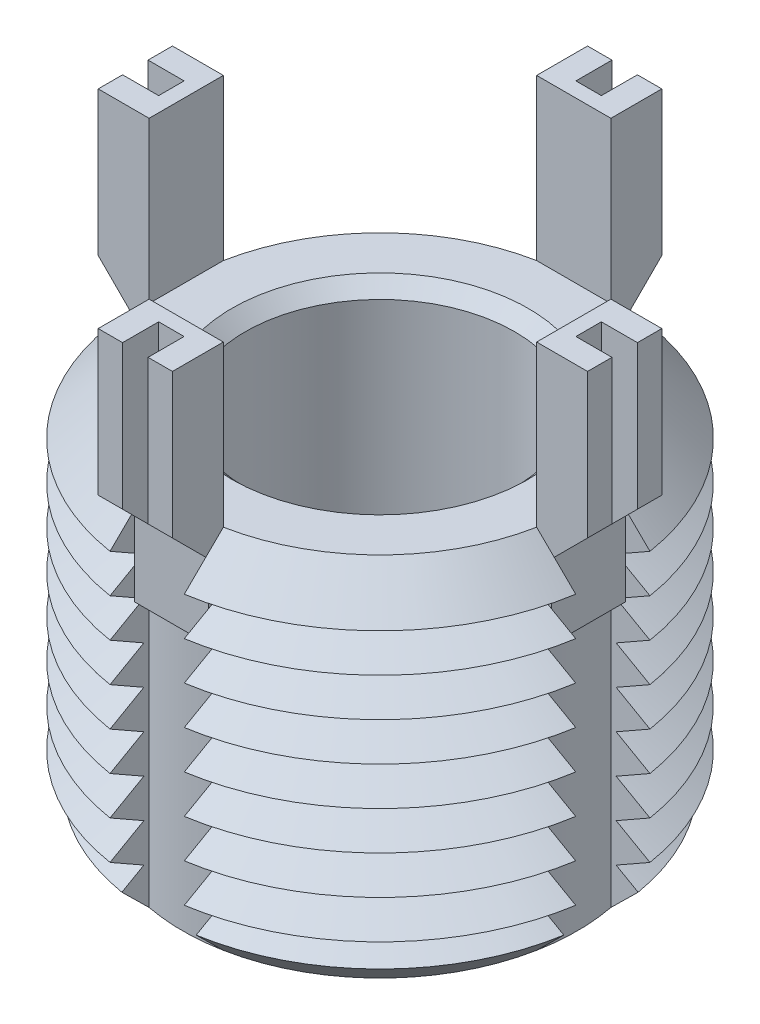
SolidWorks part; units mm, degrees
ref_plane "Front Plane" through (0, 0, 0) normal (0, 0, 1) x (1, 0, 0)
ref_plane "Top Plane" through (0, 0, 0) normal (0, 1, 0) x (1, 0, 0)
ref_plane "Right Plane" through (0, 0, 0) normal (1, 0, 0) x (0, 0, -1)
sketch "Sketch1" plane through (0, 0, 0) normal (0, 1, 0) x (1, 0, 0)
  circle A0 centre (0, 0) radius 11.1125
  dimension "D1" = 22.225
extrude "Boss-Extrude1" add sketch "Sketch1" against normal blind 17.272
chamfer "Chamfer1" distance 1.814 angle 45 2 edges at (0, -17.272, 11.1125) (0, 0, 11.1125)
sketch "Sketch2" plane through (0, 0, 0) normal (1, 0, 0) x (0, 0, -1)
  line L0 (0, 0.8859) -> (0, -9.2617) construction
sketch "Sketch3" plane through (0, 0, 0) normal (1, 0, 0) x (0, 0, -1)
  line L0 (-11.1125, -1.814) -> (-9.5415, -2.721)
  line L1 (-9.5415, -2.721) -> (-11.1125, -3.628)
  line L2 (-11.1125, -1.814) -> (-11.1125, -15.458) construction
  line L3 (-11.1125, -3.628) -> (-11.1125, -1.814)
  dimension "D1" = 1.814
revolve "Cut-Revolve1" cut sketch "Sketch3" angle 360 about L0
pattern_linear "LPattern1" count 8 spacing 1.814 along (0, -1, 0) of "Cut-Revolve1"
sketch "Sketch4" plane through (0, 0, 0) normal (0, 1, 0) x (1, 0, 0)
  line L0 (-9.1323, 1.75) -> (-10.9738, 1.75)
  line L2 (-10.9738, -1.75) -> (-9.1323, -1.75)
  arc A0 (-9.1323, 1.75) -> (-9.1323, -1.75) centre (0, 0) ccw
  arc A1 (-10.9738, 1.75) -> (-10.9738, -1.75) centre (0, 0) ccw
  circle A2 centre (0, 0) radius 11.1125 construction
  circle A3 centre (0, 0) radius 9.2985 construction
  point P1 (-9.2985, 0)
  point P3 (-11.1125, 0)
  point P13 (0, 0)
  dimension "D1" = 3.5
extrude "Cut-Extrude1" cut sketch "Sketch4" against normal up to surface (17.272 mm away)
pattern_circular "CirPattern1" count 4 over 360 about axis through (0, 0, 0) along (0, 1, 0) of "Cut-Extrude1"
sketch "Sketch5" plane through (0, 0, 0) normal (1, 0, 0) x (0, 0, -1)
  line L0 (-9.1323, 7.558) -> (-9.1323, -4.442)
  line L1 (-9.1323, -4.442) -> (-9.8323, -4.442)
  line L2 (-9.8323, -4.442) -> (-9.8323, -0.942)
  line L3 (-9.8323, -0.942) -> (-11.5323, 0.758)
  line L4 (-11.5323, 0.758) -> (-11.5323, 7.558)
  line L5 (-11.5323, 7.558) -> (-9.1323, 7.558)
  line L6 (-10.9738, -5.442) -> (-1.75, -5.442) construction
  point P9 (-1.75, 0)
  point P10 (-9.8323, -0.942)
  dimension "D1" = 1
  dimension "D2" = 12
  dimension "D3" = 8.5
  dimension "D4" = 2.4
  dimension "D5" = 0.7
  dimension "D6" = 45
extrude "Boss-Extrude3" add sketch "Sketch5" along normal mid plane 3.5
pattern_circular "CirPattern2" count 4 over 360 about axis through (0, 0, 0) along (0, 1, 0) of "Boss-Extrude3"
sketch "Sketch6" plane through (0, 7.558, 0) normal (0, 1, 0) x (1, 0, 0)
  line L0 (-11.5323, -1.75) -> (-11.5323, 1.75) construction
  line L1 (-11.5323, -0.6) -> (-9.8323, -0.6)
  line L2 (-11.5323, -0.6) -> (-11.5323, 0.6)
  line L3 (-11.5323, 0.6) -> (-9.8323, 0.6)
  line L4 (-9.8323, -0.6) -> (-9.8323, 0.6)
  line L5 (-11.5323, -0.6) -> (-9.8323, 0.6) construction
  line L6 (-11.5323, 0.6) -> (-9.8323, -0.6) construction
  line L7 (11.5323, 1.75) -> (11.5323, -1.75) construction
  line L8 (-0.6, 9.8323) -> (0.6, 9.8323)
  line L9 (-0.6, 9.8323) -> (-0.6, 11.5323)
  line L10 (-0.6, 11.5323) -> (0.6, 11.5323)
  line L11 (0.6, 9.8323) -> (0.6, 11.5323)
  line L12 (-0.6, 9.8323) -> (0.6, 11.5323) construction
  line L13 (-0.6, 11.5323) -> (0.6, 9.8323) construction
  line L14 (9.8323, -0.6) -> (11.5323, -0.6)
  line L15 (9.8323, -0.6) -> (9.8323, 0.6)
  line L16 (9.8323, 0.6) -> (11.5323, 0.6)
  line L17 (11.5323, -0.6) -> (11.5323, 0.6)
  line L18 (9.8323, -0.6) -> (11.5323, 0.6) construction
  line L19 (9.8323, 0.6) -> (11.5323, -0.6) construction
  line L20 (-0.6, -11.5323) -> (0.6, -11.5323)
  line L21 (-0.6, -11.5323) -> (-0.6, -9.8323)
  line L22 (-0.6, -9.8323) -> (0.6, -9.8323)
  line L23 (0.6, -11.5323) -> (0.6, -9.8323)
  line L24 (-0.6, -11.5323) -> (0.6, -9.8323) construction
  line L25 (-0.6, -9.8323) -> (0.6, -11.5323) construction
  line L26 (-1.75, 11.5323) -> (1.75, 11.5323) construction
  line L27 (1.75, -11.5323) -> (-1.75, -11.5323) construction
  point P0 (-10.6823, 0)
  point P7 (-11.5323, 0)
  point P8 (-11.5323, 0)
  point P9 (0, 10.6823)
  point P14 (10.6823, 0)
  point P19 (0, -10.6823)
  point P24 (0, 11.5323)
  point P25 (11.5323, 0)
  point P26 (11.5323, 0)
  point P27 (0, 11.5323)
  point P30 (0, -11.5323)
  point P33 (0, -11.5323)
  dimension "D1" = 1.2
  dimension "D2" = 1.7
extrude "Cut-Extrude3" cut sketch "Sketch6" against normal through all both and the other way through all
sketch "Sketch7" plane through (0, 0, 0) normal (0, 1, 0) x (1, 0, 0)
  circle A0 centre (0, 0) radius 6.35
  dimension "D1" = 12.7
extrude "Cut-Extrude4" cut sketch "Sketch7" against normal up to surface (17.272 mm away)
chamfer "Chamfer2" distance 0.635 angle 45 2 edges at (0, 0, 6.35) (0, -17.272, 6.35)
